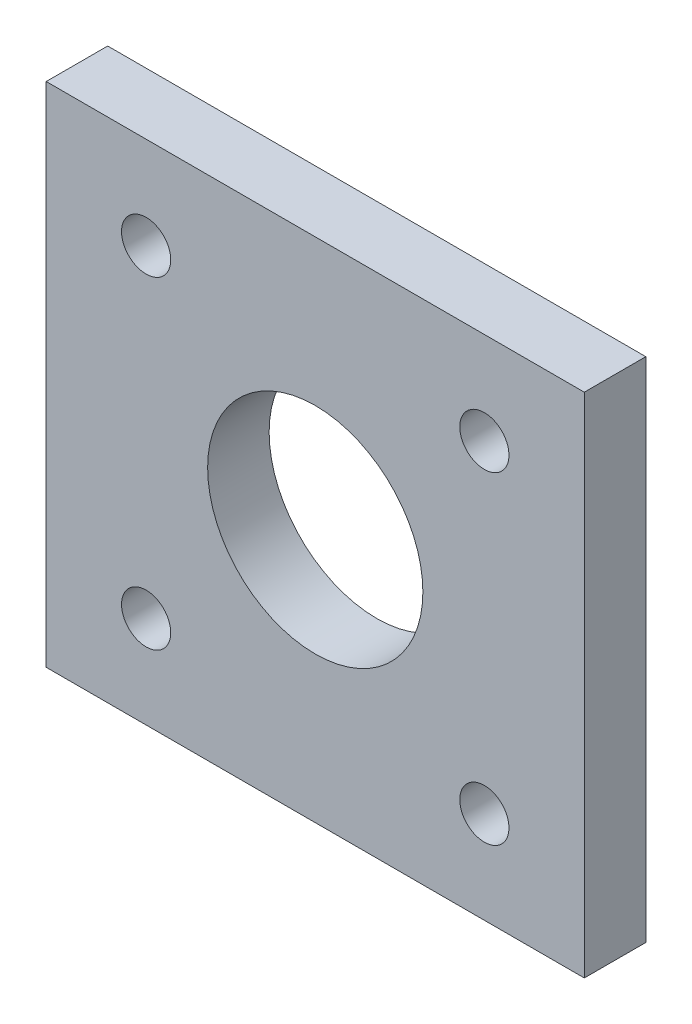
SolidWorks part; units mm, degrees
ref_plane "Спереди" through (0, 0, 0) normal (0, 0, 1) x (1, 0, 0)
ref_plane "Сверху" through (0, 0, 0) normal (0, 1, 0) x (1, 0, 0)
ref_plane "Справа" through (0, 0, 0) normal (1, 0, 0) x (0, 0, -1)
sketch "Эскиз1" plane through (0, 0, 0) normal (0, 0, 1) x (1, 0, 0)
  line L5 (-26.4245, 15.5404) -> (30.5755, 15.5404)
  line L6 (-26.4245, 15.5404) -> (-26.4245, -39.4596)
  line L7 (-26.4245, -39.4596) -> (30.5755, -39.4596)
  line L8 (30.5755, 15.5404) -> (30.5755, -39.4596)
extrude "Бобышка-Вытянуть1" add sketch "Эскиз1" along normal blind 4
sketch3d "Трехмерный эскиз2"
  line L0 (2.0755, 15.5404, 4) -> (2.0755, -44.6311, 4) construction
  line L3 (30.5755, -39.4596, 4) -> (30.5755, 15.5404, 4) construction
  dimension "D1" = 28.5
ref_plane "Плоскость6" through (2.0755, 0, 0) normal (-1, 0, 0) x (0, 0, 1)
sketch "Эскиз5" plane through (0, 0, 0) normal (0, 0, -1) x (-1, 0, 0)
  line L0 (-33.4445, -11.9596) -> (29.4057, -11.9596) construction
  line L1 (-2.0755, 15.5404) -> (-2.0755, -44.6311) construction
  line L2 (-13.0755, 16.9921) -> (-13.0755, -41.8924) construction
  line L3 (-31.442, -1.4596) -> (28.0491, -1.4596) construction
  line L4 (26.4245, -39.4596) -> (26.4245, 15.5404)
  line L5 (26.4245, 15.5404) -> (-30.5755, 15.5404)
  line L6 (-30.5755, 15.5404) -> (-30.5755, -39.4596)
  line L7 (-30.5755, -39.4596) -> (26.4245, -39.4596)
  line L8 (26.4245, -39.4596) -> (26.4245, 15.5404)
  line L9 (26.4245, 15.5404) -> (-30.5755, 15.5404)
  line L10 (-30.5755, 15.5404) -> (-30.5755, -39.4596)
  line L11 (-30.5755, -39.4596) -> (26.4245, -39.4596)
  line L12 (-32.3833, -22.4596) -> (28.4535, -22.4596) construction
  line L13 (-2.0755, 16.6817) -> (-2.0755, -41.1361) construction
  circle A0 centre (-2.0755, -11.9596) radius 7
  circle A1 centre (-2.0755, -11.9596) radius 9.5
  circle A2 centre (-13.0755, -1.4596) radius 1.6
  circle A3 centre (-13.0755, -22.4596) radius 1.6
  circle A4 centre (8.9245, -22.4596) radius 1.6
  circle A5 centre (8.9245, -1.4596) radius 1.6
  circle A6 centre (-2.0755, -11.9596) radius 15 construction
  dimension "D4" = 19
  dimension "D5" = 14
  dimension "D10" = 3.2
  dimension "D11" = 3.2
  dimension "D13" = 30
  dimension "D2" = 27.5
  dimension "D3" = 55
  dimension "D6" = 17.5
  dimension "D7" = 57
  dimension "D8" = 10.5
  dimension "D9" = 10.5
  dimension "D12" = 28.5
  dimension "D1" = 0
extrude "Вырез-Вытянуть1" cut sketch "Эскиз5" against normal through all contours A0 | A2 | A5 | A4 | A3
sketch "Эскиз6" plane through (0, 0, 4) normal (0, 0, 1) x (1, 0, 0)
  circle A33 centre (-8.9245, -22.4596) radius 1.6 construction
  circle A34 centre (13.0755, -22.4596) radius 1.6 construction
  circle A35 centre (13.0755, -1.4596) radius 1.6 construction
  circle A36 centre (-8.9245, -1.4596) radius 1.6 construction
  circle A37 centre (-8.9245, -22.4596) radius 1.6
  circle A38 centre (13.0755, -22.4596) radius 1.6
  circle A39 centre (13.0755, -1.4596) radius 1.6
  circle A40 centre (-8.9245, -1.4596) radius 1.6
  line B0 (10.2756, -20.6187) -> (10.2754, -24.3001)
  line B1 (15.8756, -20.6191) -> (15.8754, -24.3004)
  line B2 (13.0757, -19.4096) -> (15.8756, -20.6191)
  line B3 (10.2756, -20.6187) -> (13.0757, -19.4096)
  line B4 (10.2754, -24.3001) -> (13.0753, -25.5096)
  line B5 (13.0753, -25.5096) -> (15.8754, -24.3004)
  circle B6 centre (13.0755, -22.4596) radius 1.5
  circle B7 centre (13.0755, -22.4596) radius 2.8 construction
  line B8 (-11.7244, 0.3813) -> (-11.7246, -3.3001)
  line B9 (-6.1244, 0.3809) -> (-6.1246, -3.3004)
  line B10 (-8.9243, 1.5904) -> (-6.1244, 0.3809)
  line B11 (-11.7244, 0.3813) -> (-8.9243, 1.5904)
  line B12 (-11.7246, -3.3001) -> (-8.9247, -4.5096)
  line B13 (-8.9247, -4.5096) -> (-6.1246, -3.3004)
  circle B14 centre (-8.9245, -1.4596) radius 1.5
  circle B15 centre (-8.9245, -1.4596) radius 2.8 construction
  line B16 (10.2756, 0.3813) -> (10.2754, -3.3001)
  line B17 (15.8756, 0.3809) -> (15.8754, -3.3004)
  line B18 (13.0757, 1.5904) -> (15.8756, 0.3809)
  line B19 (10.2756, 0.3813) -> (13.0757, 1.5904)
  line B20 (10.2754, -3.3001) -> (13.0753, -4.5096)
  line B21 (13.0753, -4.5096) -> (15.8754, -3.3004)
  circle B22 centre (13.0755, -1.4596) radius 1.5
  circle B23 centre (13.0755, -1.4596) radius 2.8 construction
  line B24 (-11.7244, -20.6187) -> (-11.7246, -24.3001)
  line B25 (-6.1244, -20.6191) -> (-6.1246, -24.3004)
  line B26 (-8.9243, -19.4096) -> (-6.1244, -20.6191)
  line B27 (-11.7244, -20.6187) -> (-8.9243, -19.4096)
  line B28 (-11.7246, -24.3001) -> (-8.9247, -25.5096)
  line B29 (-8.9247, -25.5096) -> (-6.1246, -24.3004)
  circle B30 centre (-8.9245, -22.4596) radius 1.5
  circle B31 centre (-8.9245, -22.4596) radius 2.8 construction
sketch_block_instance "Блок1-1"
sketch_block "Блок1"
sketch_block_instance "Блок1-3"
sketch_block_instance "Блок1-4"
sketch_block_instance "Блок1-5"
extrude "Вырез-Вытянуть3" [suppressed] cut sketch "Эскиз6" against normal blind 2.5 contours B12 B13 B9 B10 B11 B8 M25 | B20 B21 B17 B18 B19 B16 M26 | B4 B5 B1 B2 B3 B0 M24 | B28 B29 B25 B26 B27 B24 M40 | A38
sketch "Эскиз7" plane through (0, 0, 4) normal (0, 0, 1) x (1, 0, 0)
  line L0 (-15.4245, 4.5404) -> (-15.4245, -28.4596)
  line L1 (-15.4245, -28.4596) -> (19.5755, -28.4596)
  line L2 (19.5755, -28.4596) -> (19.5755, 4.5404)
  line L3 (19.5755, 4.5404) -> (-15.4245, 4.5404)
  line L4 (-26.4245, 15.5404) -> (-26.4245, -39.4596)
  line L5 (-26.4245, -39.4596) -> (30.5755, -39.4596)
  line L6 (30.5755, -39.4596) -> (30.5755, 15.5404)
  line L7 (30.5755, 15.5404) -> (-26.4245, 15.5404)
  line L8 (-26.4245, 15.5404) -> (-26.4245, -39.4596)
  line L9 (-26.4245, -39.4596) -> (30.5755, -39.4596)
  line L10 (30.5755, -39.4596) -> (30.5755, 15.5404)
  line L11 (30.5755, 15.5404) -> (-26.4245, 15.5404)
  dimension "D1" = 0
  dimension "D2" = 11
extrude "Вырез-Вытянуть4" cut sketch "Эскиз7" against normal blind 10 contours L3 L2 L1 L0 M33 M30 M31 M32
